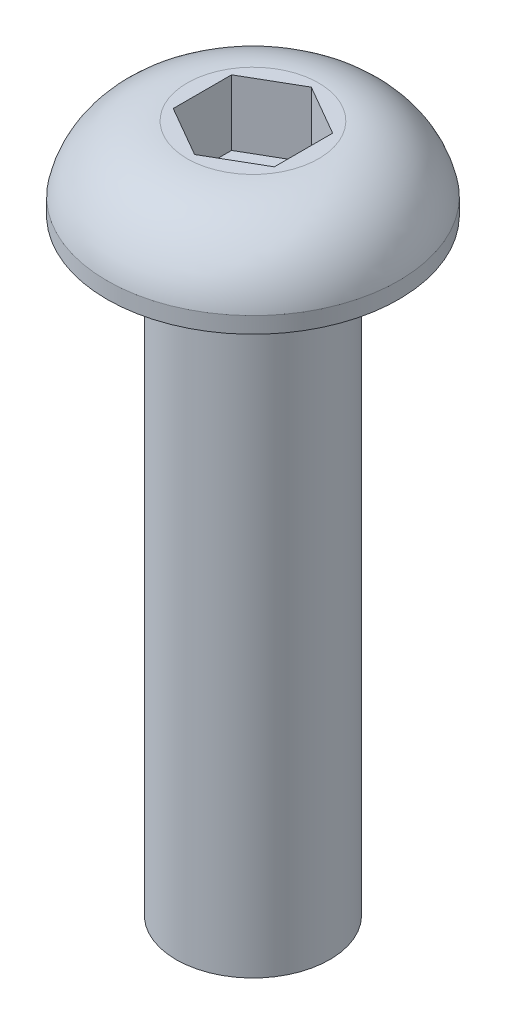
SolidWorks part; units mm, degrees
ref_plane "Plane1" through (0, 0, 0) normal (0, 0, 1) x (1, 0, 0)
ref_plane "Plane2" through (0, 0, 0) normal (0, 1, 0) x (1, 0, 0)
ref_plane "Plane3" through (0, 0, 0) normal (1, 0, 0) x (0, 0, -1)
sketch "Sketch1" plane through (0, 0, 0) normal (0, 0, 1) x (1, 0, 0)
  line L0 (0, 0) -> (2.0637, 0)
  line L1 (2.413, -2.5654) -> (4.5847, -2.5654)
  line L2 (4.5847, -2.0574) -> (4.5847, -2.5654)
  line L4 (2.413, -2.5654) -> (2.413, -21.6154)
  line L5 (0, 25.4) -> (0, -50.8) construction
  line L6 (2.413, -21.6154) -> (0, -21.6154)
  line L7 (0, 0) -> (0, -21.6154)
  arc A0 (2.0637, 0) -> (4.5847, -2.0574) centre (2.0637, -2.5732) cw
revolve "Screw" add sketch "Sketch1" angle 360 about L5
sketch "Sketch2" plane through (0, 0, 0) normal (0, 1, 0) x (-1, 0, 0)
  line L0 (0, -5.08) -> (0, 5.08) construction
  line L1 (11.7475, 0) -> (-14.9225, 0) construction
  line L2 (-1.5875, -0.9165) -> (-1.5875, 0.9165)
  line L3 (0, 1.8331) -> (-1.5875, 0.9165)
  line L4 (0, 1.8331) -> (1.5875, 0.9165)
  line L5 (1.5875, -0.9165) -> (1.5875, 0.9165)
  line L6 (0, -1.8331) -> (-1.5875, -0.9165)
  line L7 (0, -1.8331) -> (1.5875, -0.9165)
  point P8 (-1.5875, 0)
extrude "HexCut" cut sketch "Sketch2" against normal blind 2.0574
equation "\"FlatDia@Sketch1\"=\"HexWidth@Sketch2\"*1.3"
equation "\"Depth@HexCut\"=\"CapHeight@Sketch1\"-\"FlatFace@Sketch1\""
